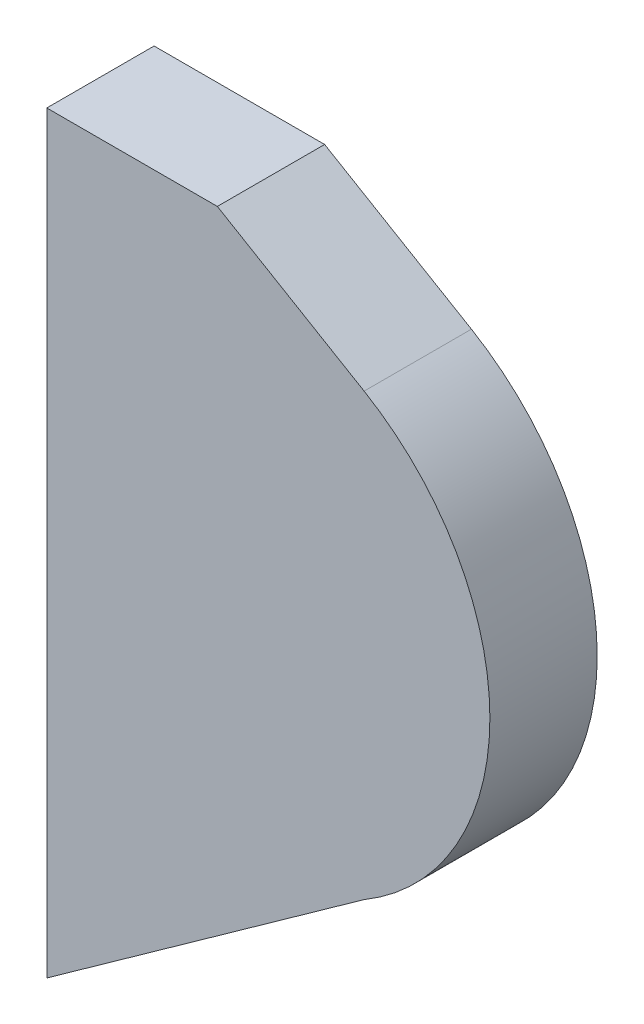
SolidWorks part; units mm, degrees
ref_plane "Front Plane" through (0, 0, 0) normal (0, 0, 1) x (1, 0, 0)
ref_plane "Top Plane" through (0, 0, 0) normal (0, 1, 0) x (1, 0, 0)
ref_plane "Right Plane" through (0, 0, 0) normal (1, 0, 0) x (0, 0, -1)
sketch "Sketch1" plane through (0, 0, 0) normal (0, 0, 1) x (1, 0, 0)
  line L0 (0, 0) -> (0, 35.1119)
  line L1 (0, 35.1119) -> (7.9473, 35.1119)
  line L2 (7.9473, 35.1119) -> (14.7875, 31.078)
  line L3 (14.7875, 10.5575) -> (0, 0)
  arc A0 (14.7875, 31.078) -> (14.7875, 10.5575) centre (8.7366, 20.8177) cw
extrude "Extrude1" add sketch "Sketch1" along normal blind 5
sketch "Sketch2" plane through (0, 0, 5) normal (0, 0, 1) x (1, 0, 0)
  arc A0 (14.7875, 10.5575) -> (14.7875, 31.078) centre (8.7366, 20.8177) ccw construction
  arc A1 (2.8992, 10.4345) -> (14.7875, 31.078) centre (8.7366, 20.8177) ccw
